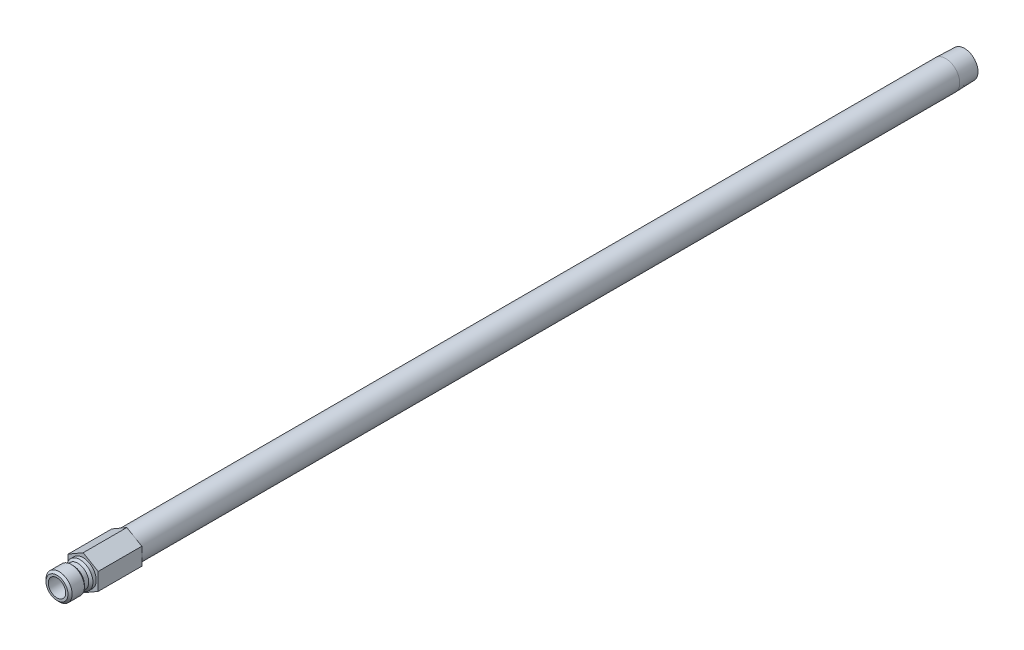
SolidWorks part; units mm, degrees
ref_plane "Front Plane" through (0, 0, 0) normal (0, 0, 1) x (1, 0, 0)
ref_plane "Top Plane" through (0, 0, 0) normal (0, 1, 0) x (1, 0, 0)
ref_plane "Right Plane" through (0, 0, 0) normal (1, 0, 0) x (0, 0, -1)
sketch "Sketch1" plane through (0, 0, 0) normal (1, 0, 0) x (0, 0, -1)
  line L0 (0, 0) -> (-12.7, 0) construction
  line L1 (-9.525, 3.175) -> (-9.525, 4.0005)
  line L2 (-3.556, 4.0005) -> (-3.556, 0) construction
  line L3 (-8.763, 4.7625) -> (-4.318, 4.7625)
  line L4 (0, 5.1435) -> (0, 3.4163) construction
  line L5 (-3.556, 4.0005) -> (-1.9685, 4.0005)
  line L6 (-1.2065, 4.7625) -> (0, 4.7625)
  line L7 (0, 4.7625) -> (0, 5.1435)
  line L8 (-3.556, 4.0005) -> (-4.318, 4.7625)
  line L9 (-1.9685, 4.0005) -> (-1.2065, 4.7625)
  line L10 (-9.525, 4.0005) -> (-8.763, 4.7625)
  line L12 (0, 5.1435) -> (313.817, 5.1435)
  line L13 (313.817, 5.1435) -> (320.675, 4.9292)
  line L14 (320.675, 4.9292) -> (320.675, 2.3813)
  line L15 (0, 0) -> (15.875, 0) construction
  line L16 (15.875, 0) -> (15.875, 4.7625) construction
  line L17 (15.875, 4.7625) -> (0, 4.7625) construction
  line L18 (0.127, 2.3813) -> (320.675, 2.3813)
  line L19 (0.127, 3.175) -> (-9.525, 3.175)
  line L20 (0, 3.175) -> (0, 0) construction
  line L21 (0.127, 2.3813) -> (0.127, 3.175)
  dimension "D1" = 9.525
  dimension "D2" = 1.5875
  dimension "D3" = 0.762
  dimension "D4" = 45
  dimension "D5" = 5.969
  dimension "D6" = 45
  dimension "D7" = 1.79
  dimension "D8" = 6.858
  dimension "D9" = 330.2
  dimension "D10" = 3.175
  dimension "D11" = 25.4
  dimension "D12" = 4.7625
  dimension "D13" = 6.35
  dimension "D14" = 9.525
  dimension "D15" = 10.287
  dimension "D16" = 9.652
revolve "Revolve1" add sketch "Sketch1" angle 360 about L0
sketch "Sketch2" plane through (0, 0, 0) normal (0, 0, 1) x (1, 0, 0)
  line L1 (-5.461, 3.1529) -> (-5.461, -3.1529)
  line L2 (-5.461, -3.1529) -> (0, -6.3058)
  line L3 (0, -6.3058) -> (5.461, -3.1529)
  line L4 (5.461, -3.1529) -> (5.461, 3.1529)
  line L5 (5.461, 3.1529) -> (0, 6.3058)
  line L6 (0, 6.3058) -> (-5.461, 3.1529)
  circle A0 centre (0, 0) radius 5.461 construction
  circle A1 centre (0, 0) radius 2.3812 construction
  circle A2 centre (0, 0) radius 2.3812
  dimension "D1" = 10.922
extrude "Boss-Extrude1" add sketch "Sketch2" against normal up to vertex (15.875 mm away) from vertex at 0
